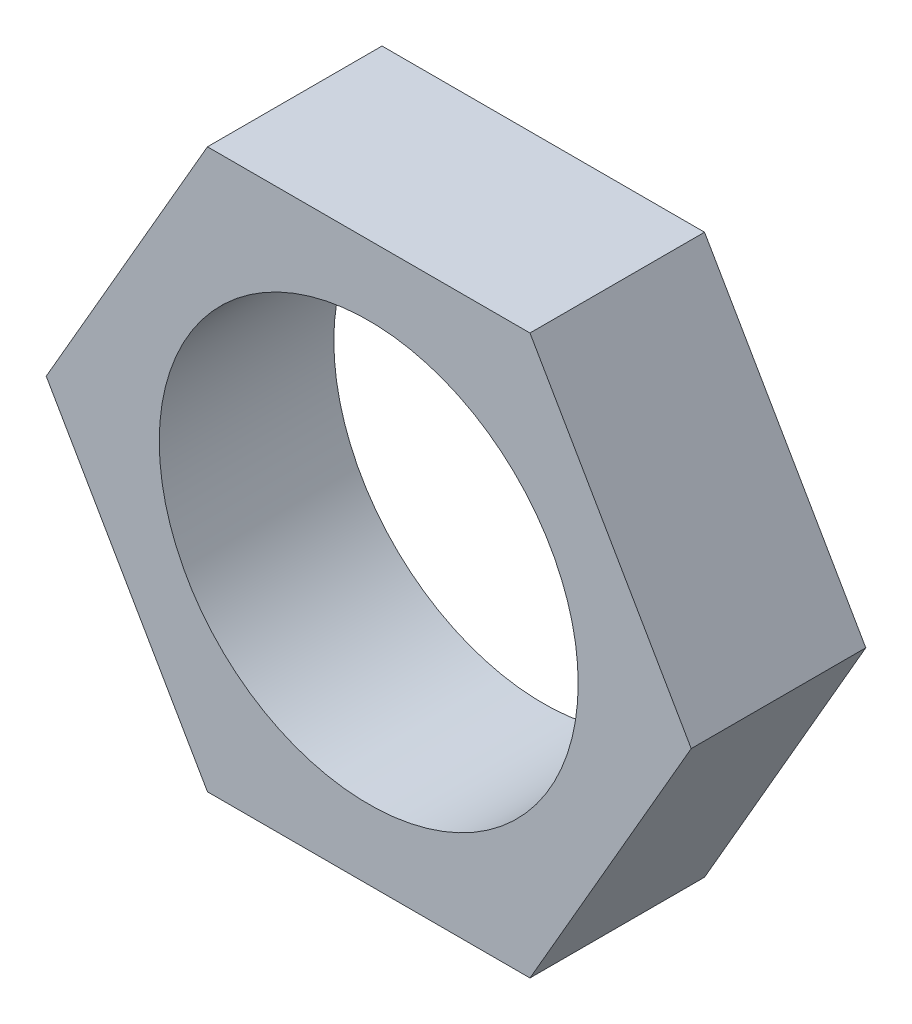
SolidWorks part; units mm, degrees
ref_plane "Front Plane" through (0, 0, 0) normal (0, 0, 1) x (1, 0, 0)
ref_plane "Top Plane" through (0, 0, 0) normal (0, 1, 0) x (1, 0, 0)
ref_plane "Right Plane" through (0, 0, 0) normal (1, 0, 0) x (0, 0, -1)
sketch "Sketch1" plane through (0, 0, 0) normal (0, 0, 1) x (1, 0, 0)
  line L1 (9.2376, 0) -> (4.6188, 8)
  line L2 (4.6188, 8) -> (-4.6188, 8)
  line L3 (-4.6188, 8) -> (-9.2376, 0)
  line L4 (-9.2376, 0) -> (-4.6188, -8)
  line L5 (-4.6188, -8) -> (4.6188, -8)
  line L6 (4.6188, -8) -> (9.2376, 0)
  circle A0 centre (0, 0) radius 8 construction
  circle A1 centre (0, 0) radius 6
  dimension "D1" = 12
  dimension "D2" = 16
extrude "Boss-Extrude1" add sketch "Sketch1" along normal blind 5
